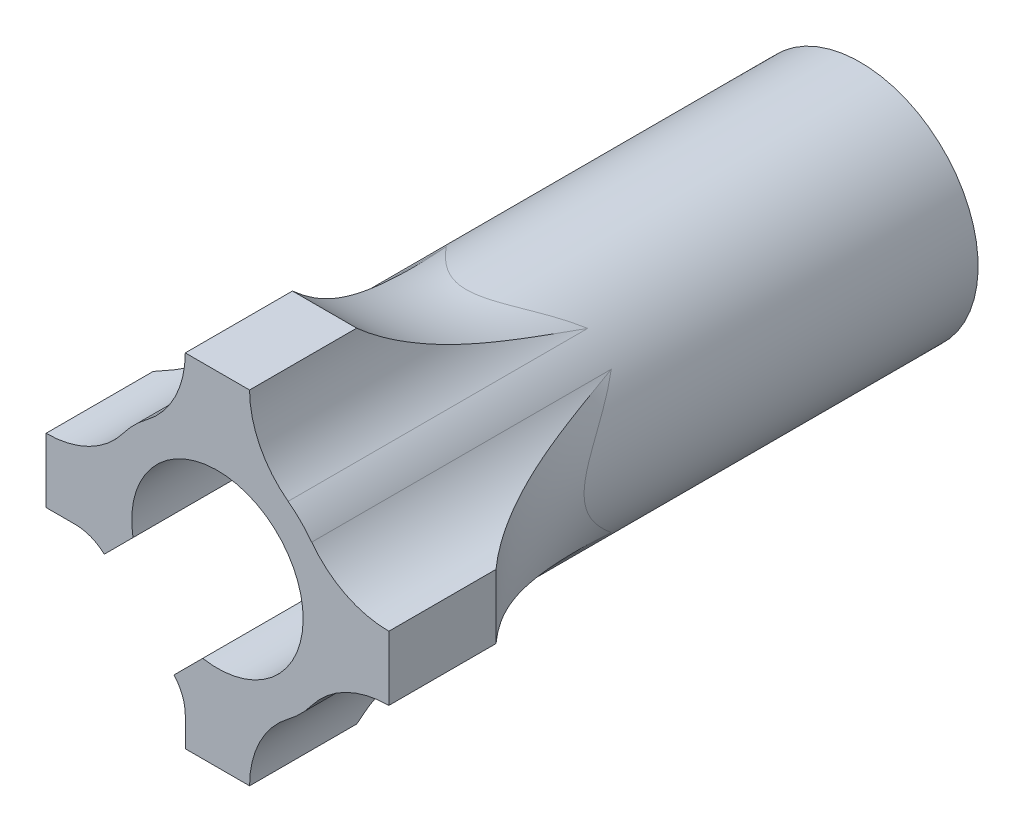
SolidWorks part; units mm, degrees
ref_plane "Front Plane" through (0, 0, 0) normal (0, 0, 1) x (1, 0, 0)
ref_plane "Top Plane" through (0, 0, 0) normal (0, 1, 0) x (1, 0, 0)
ref_plane "Right Plane" through (0, 0, 0) normal (1, 0, 0) x (0, 0, -1)
sketch "Sketch1" plane through (0, 0, 0) normal (0, 0, 1) x (1, 0, 0)
  line L1 (4.6188, 0) -> (2.3094, 4)
  line L2 (2.3094, 4) -> (-2.3094, 4)
  line L3 (-2.3094, 4) -> (-4.6188, 0)
  line L4 (-4.6188, 0) -> (-2.3094, -4)
  line L5 (-2.3094, -4) -> (2.3094, -4)
  line L6 (2.3094, -4) -> (4.6188, 0)
  circle A0 centre (0, 0) radius 5.5
  circle A1 centre (0, 0) radius 4 construction
  dimension "D1" = 11
  dimension "D2" = 8
extrude "Boss-Extrude1" add sketch "Sketch1" along normal blind 8
sketch "Sketch2" plane through (0, 0, 8) normal (0, 0, 1) x (1, 0, 0)
  line L0 (4.6188, 0) -> (2.3094, 4) construction
  circle A0 centre (0, 0) radius 4
  circle A1 centre (0, 0) radius 5.5
  circle A2 centre (0, 0) radius 5.5
  dimension "D1" = 0
extrude "Boss-Extrude2" add sketch "Sketch2" along normal blind 22
sketch "Sketch3" plane through (0, 0, 30) normal (0, 0, 1) x (1, 0, 0)
  line L0 (0, 0) -> (4.8635, 4.8635) construction
  line L1 (-1.5, 3) -> (1.5, 3)
  line L2 (-1.5, 3) -> (-1.5, 8)
  line L3 (-1.5, 8) -> (1.5, 8)
  line L4 (1.5, 3) -> (1.5, 8)
  line L5 (6.5308, 0) -> (-6.4417, 0) construction
  line L6 (0, -6.1298) -> (0, 5.9006) construction
  line L7 (3, 1.5) -> (8, 1.5)
  line L8 (8, -1.5) -> (8, 1.5)
  line L9 (3, -1.5) -> (8, -1.5)
  line L10 (3, -1.5) -> (3, 1.5)
  line L11 (1.5, -3) -> (1.5, -8)
  line L12 (-1.5, -8) -> (1.5, -8)
  line L13 (-1.5, -3) -> (-1.5, -8)
  line L14 (-1.5, -3) -> (1.5, -3)
  line L15 (-3, -1.5) -> (-3, 1.5)
  line L16 (-3, -1.5) -> (-8, -1.5)
  line L17 (-8, -1.5) -> (-8, 1.5)
  line L18 (-3, 1.5) -> (-8, 1.5)
  point P4 (0, 3)
  dimension "D1" = 3
  dimension "D2" = 8
  dimension "D3" = 3
  dimension "D4" = 45
extrude "Boss-Extrude3" add sketch "Sketch3" along normal mid plane 10
fillet "Fillet1" radius 10 4 edges at (-5.5, 0, 25) (0, -5.5, 25) (5.5, 0, 25) (0, 5.5, 25)
sketch "Sketch4" plane through (0, 0, 30) normal (0, 0, 1) x (1, 0, 0)
  circle A0 centre (0, 0) radius 4
  arc A1 (-1.5, 3.7081) -> (-3.7081, 1.5) centre (0, 0) ccw construction
extrude "Cut-Extrude1" cut sketch "Sketch4" against normal mid plane 12
fillet "Fillet2" radius 4.5 6 edges at (1.5, -5.2915, 23.8869) (5.2915, -1.5, 23.8869) (-5.2915, 1.5, 23.8869) (-1.5, 5.2915, 23.8869) (1.5, 5.2915, 23.8869) (5.2915, 1.5, 23.8869)
fillet "Fillet3" radius 2 2 edges at (-1.5, -5.2915, 23.8869) (-5.2915, -1.5, 23.8869)
ref_plane "Plane1" through (0, 0, 0) normal (0.7071, 0.7071, 0) x (0.7071, -0.7071, 0)
sketch "Sketch5" plane through (0, 0, 0) normal (0.7071, 0.7071, 0) x (0.7071, -0.7071, 0)
  line L1 (2.3, 0.7278) -> (-2.3, 0.7278)
  line L2 (2.3, 0.7278) -> (2.3, -36.9383)
  line L3 (2.3, -36.9383) -> (-2.3, -36.9383)
  line L4 (-2.3, 0.7278) -> (-2.3, -36.9383)
  dimension "D1" = 4.6
  dimension "D2" = 2.3
extrude "Cut-Extrude2" cut sketch "Sketch5" against normal blind 12
sketch "Sketch6" plane through (-8, 0, 0) normal (-1, 0, 0) x (0, 0, 1)
  line L0 (35, -8) -> (25, -8) construction
  line L1 (35, 8) -> (30, 8)
  line L2 (35, 8) -> (35, -8)
  line L3 (35, -8) -> (30, -8)
  line L4 (30, 8) -> (30, -8)
extrude "Cut-Extrude3" cut sketch "Sketch6" against normal through all
